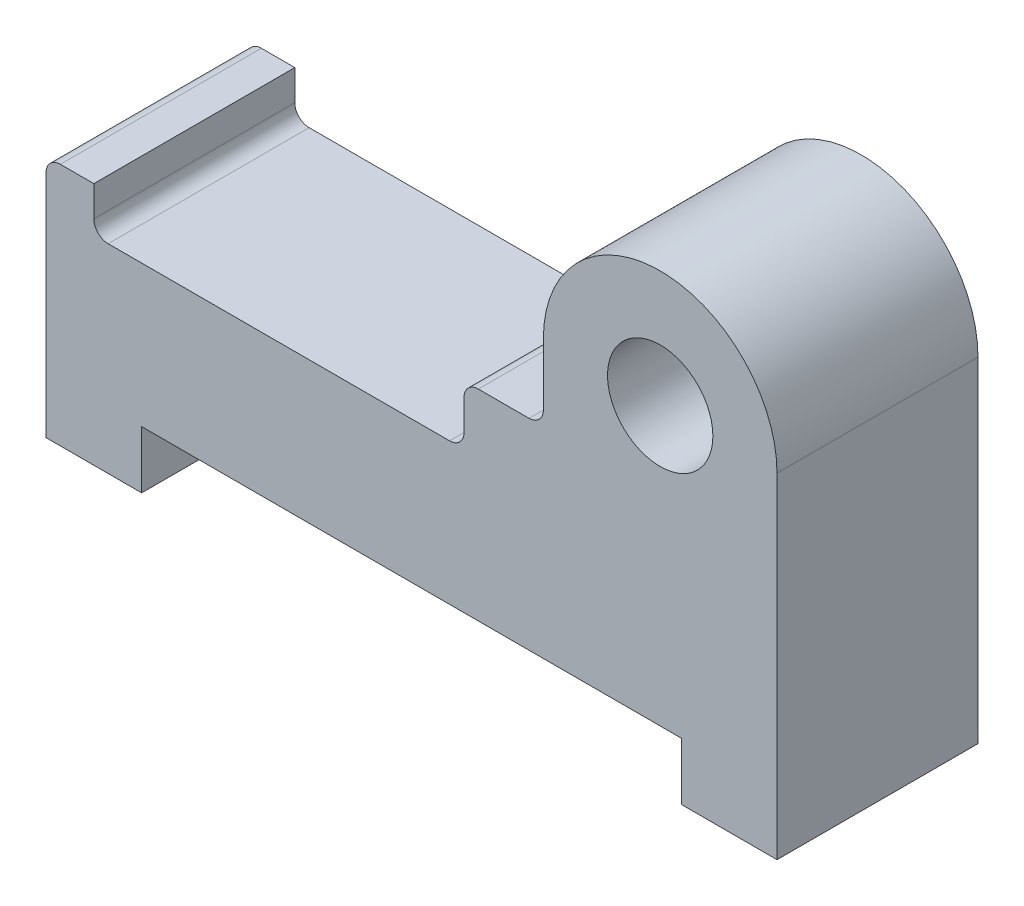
SolidWorks part; units mm, degrees
ref_plane "Front Plane" through (0, 0, 0) normal (0, 0, 1) x (1, 0, 0)
ref_plane "Top Plane" through (0, 0, 0) normal (0, 1, 0) x (1, 0, 0)
ref_plane "Right Plane" through (0, 0, 0) normal (1, 0, 0) x (0, 0, -1)
sketch "Sketch1" plane through (0, 0, 0) normal (0, 0, 1) x (1, 0, 0)
  line L0 (0, 0) -> (20, 0)
  line L1 (20, 0) -> (20, 12)
  line L2 (20, 12) -> (132.8502, 12)
  line L3 (132.8502, 12) -> (132.8502, 0)
  line L4 (132.8502, 0) -> (152.8502, 0)
  line L5 (152.8502, 0) -> (152.8502, 70)
  line L6 (104, 70) -> (104, 57)
  line L7 (101, 54) -> (90.3995, 54)
  line L8 (87.3995, 51) -> (87.3995, 44.6175)
  line L9 (84.3995, 41.6175) -> (13, 41.6175)
  line L10 (10, 44.6175) -> (10, 51)
  line L11 (10, 51) -> (3, 51)
  line L12 (0, 48) -> (0, 0)
  arc A0 (152.8502, 70) -> (104, 70) centre (128.4251, 70) ccw
  arc A1 (104, 57) -> (101, 54) centre (101, 57) cw
  arc A2 (90.3995, 54) -> (87.3995, 51) centre (90.3995, 51) ccw
  arc A3 (87.3995, 44.6175) -> (84.3995, 41.6175) centre (84.3995, 44.6175) cw
  arc A4 (13, 41.6175) -> (10, 44.6175) centre (13, 44.6175) cw
  arc A5 (3, 51) -> (0, 48) centre (3, 48) ccw
  circle A6 centre (128.4251, 70) radius 11.0137
  point P19 (104, 54)
  point P22 (87.3995, 54)
  point P27 (10, 41.6175)
  point P30 (10, 51)
extrude "Extrude1" add sketch "Sketch1" along normal blind 42.0251
sketch "Sketch2" plane through (0, 0, 42.0251) normal (0, 0, -1) x (-1, 0, 0)
  line L0 (-84.3995, 41.6175) -> (-13, 41.6175) construction
  line L1 (-58.6997, 41.6175) -> (-38.6997, 41.6175)
  line L2 (-58.6997, 41.6175) -> (-58.6997, 56.6175)
  line L3 (-58.6997, 56.6175) -> (-38.6997, 56.6175)
  line L4 (-38.6997, 41.6175) -> (-38.6997, 56.6175)
  line L5 (-58.6997, 41.6175) -> (-38.6997, 56.6175) construction
  line L6 (-58.6997, 56.6175) -> (-38.6997, 41.6175) construction
  point P0 (-48.6997, 49.1175)
  point P7 (-48.6997, 41.6175)
  point P8 (-48.6997, 56.6175)
  dimension "D1" = 20
  dimension "D2" = 15
